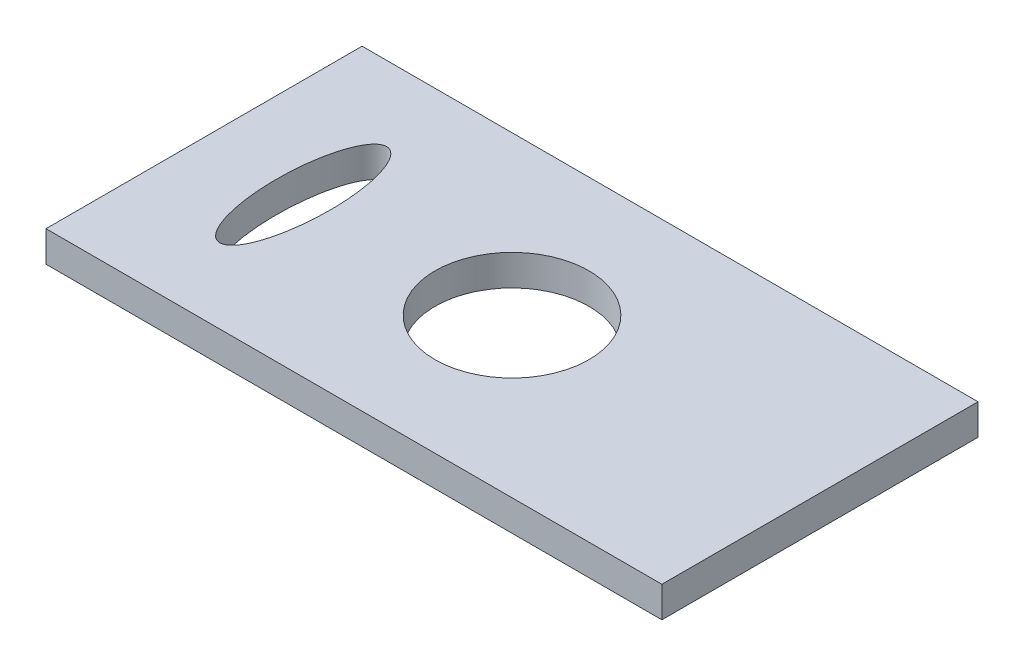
SolidWorks part; units mm, degrees
ref_plane "Front Plane" through (0, 0, 0) normal (0, 0, 1) x (1, 0, 0)
ref_plane "Top Plane" through (0, 0, 0) normal (0, 1, 0) x (1, 0, 0)
ref_plane "Right Plane" through (0, 0, 0) normal (1, 0, 0) x (0, 0, -1)
sketch "Sketch1" plane through (0, 0, 0) normal (0, 1, 0) x (1, 0, 0)
  line L1 (-100, 51.3258) -> (100, 51.3258)
  line L2 (-100, 51.3258) -> (-100, -51.3258)
  line L3 (-100, -51.3258) -> (100, -51.3258)
  line L4 (100, 51.3258) -> (100, -51.3258)
  line L5 (-100, 51.3258) -> (100, -51.3258) construction
  line L6 (-100, -51.3258) -> (100, 51.3258) construction
  circle A0 centre (0, 0) radius 25
  ellipse E0 centre (-67.803, 0) end of major axis (-67.803, -27.0833) minor radius 8.7121
  point P0 (0, 0)
  dimension "D2" = 50
  dimension "D1" = 200
extrude "Boss-Extrude1" add sketch "Sketch1" along normal blind 10
